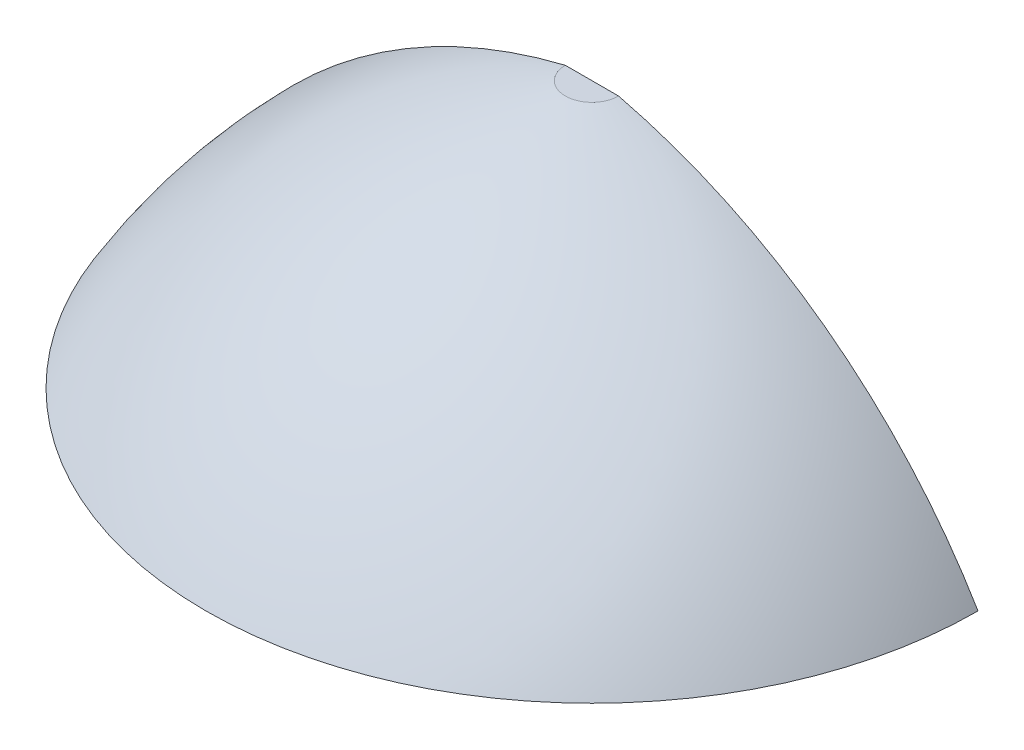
SolidWorks part; units mm, degrees
ref_plane "Front" through (0, 0, 0) normal (0, 0, 1) x (1, 0, 0)
ref_plane "Top" through (0, 0, 0) normal (0, 1, 0) x (1, 0, 0)
ref_plane "Right" through (0, 0, 0) normal (1, 0, 0) x (0, 0, -1)
sketch "Sketch1" plane through (0, 0, 0) normal (0, 0, 1) x (1, 0, 0)
  line L0 (0, 37.2211) -> (0, -33.0317) construction
  line L1 (0, -9.4802) -> (3.683, -9.4802)
  line L2 (0, -6.9402) -> (0.254, -6.9402)
  line L3 (0, -6.9402) -> (0, -9.4802)
  arc A0 (0.254, -6.9402) -> (3.683, -9.4802) centre (-1.0416, -12.2739) cw
  dimension "D3" = 0.254
  dimension "D1" = 2.54
  dimension "D2" = 3.683
revolve "Base-Revolve" add sketch "Sketch1" angle 180 about L0
